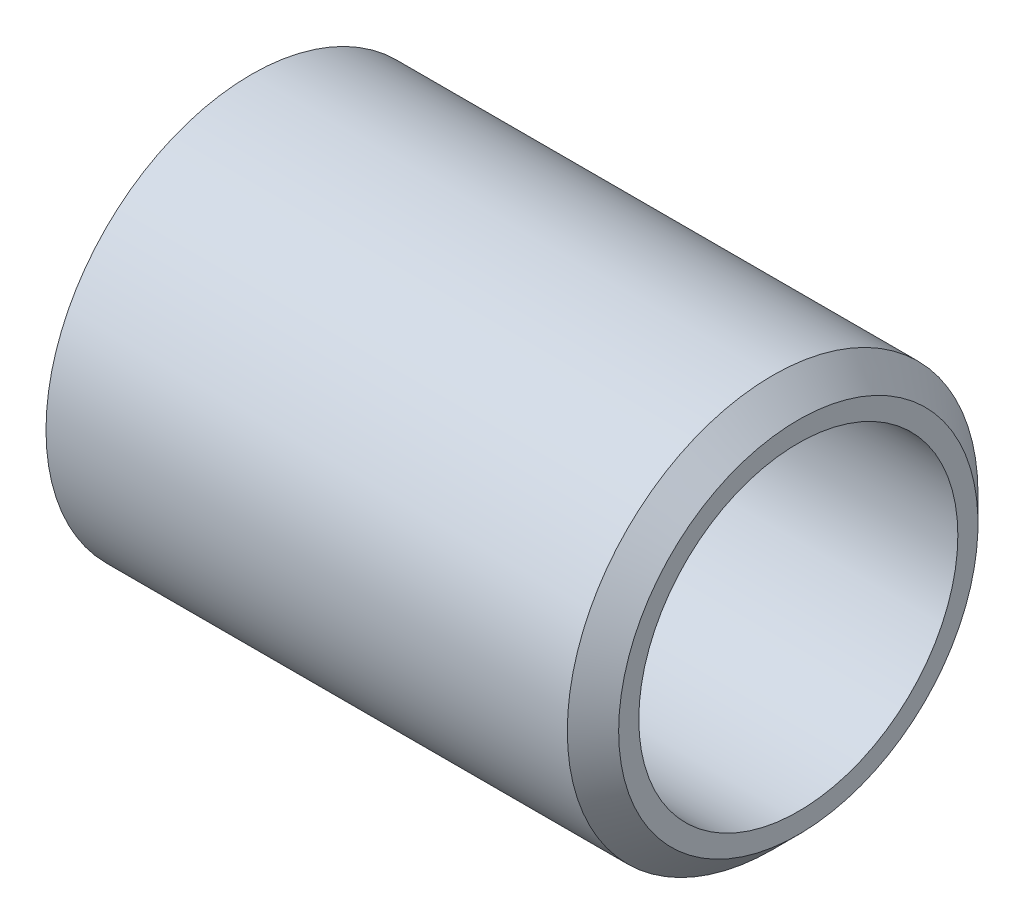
SolidWorks part; units mm, degrees
ref_plane "Plane1" through (0, 0, 0) normal (0, 0, 1) x (1, 0, 0)
ref_plane "Plane2" through (0, 0, 0) normal (0, 1, 0) x (1, 0, 0)
ref_plane "Plane3" through (0, 0, 0) normal (1, 0, 0) x (0, 0, -1)
sketch "Sketch1" plane through (0, 0, 0) normal (0, 0, 1) x (1, 0, 0)
  line L0 (0, 0) -> (76.2, 0) construction
  line L1 (0, 24.6126) -> (0, 28.6068)
  line L4 (0, 28.6068) -> (72.6242, 28.6068)
  line L5 (72.6242, 28.6068) -> (76.2, 25.0309)
  line L6 (76.2, 25.0309) -> (76.2, 22.225)
  line L7 (76.2, 22.225) -> (2.3876, 22.225)
  line L8 (72.6242, -28.6068) -> (76.2, -25.0309) construction
  line L9 (76.2, -22.225) -> (0, -22.225) construction
  line L10 (0, -28.6068) -> (72.6242, -28.6068) construction
  arc A1 (0, 24.6126) -> (2.3876, 22.225) centre (2.3876, 24.6126) ccw
  point P20 (0, 22.225)
  dimension "Head_radius" = 2.3876
  dimension "D1" = 50.0618
  dimension "Hole_dia" = 44.45
  dimension "Body_dia" = 57.2135
  dimension "D2" = 45
  dimension "Body_len" = 76.2
revolve "BaseBody" add sketch "Sketch1" angle 360 about L0
equation "\"D1@Sketch1\" = \"Body_dia@Sketch1\" * .875"
